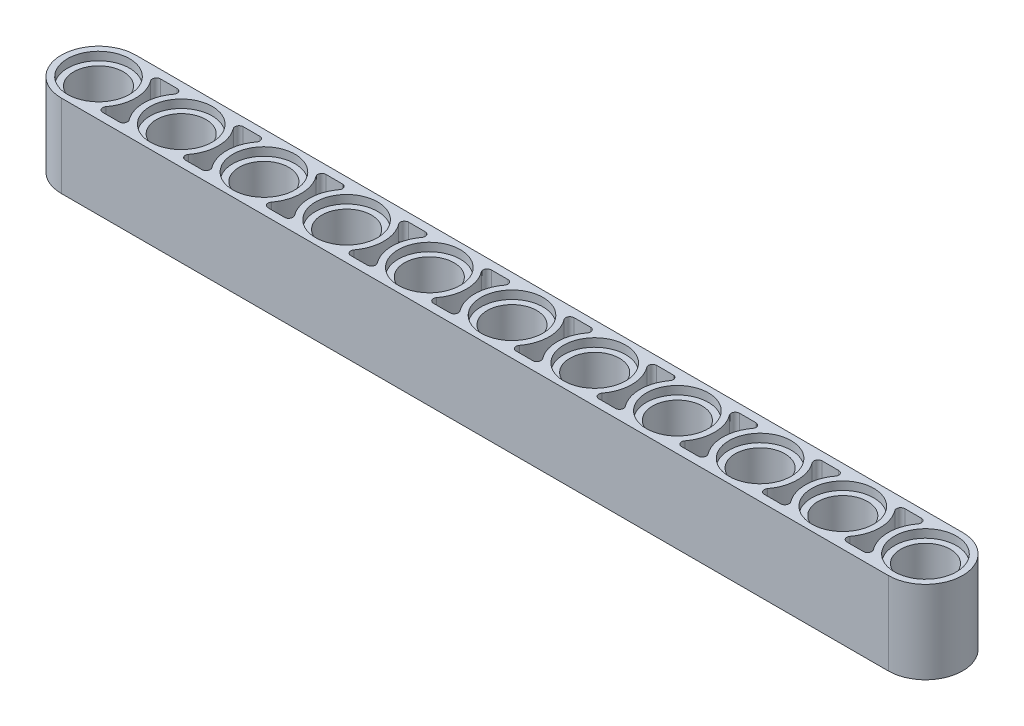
SolidWorks part; units mm, degrees
ref_plane "Front Plane" through (0, 0, 0) normal (0, 0, 1) x (1, 0, 0)
ref_plane "Top Plane" through (0, 0, 0) normal (0, 1, 0) x (1, 0, 0)
ref_plane "Right Plane" through (0, 0, 0) normal (1, 0, 0) x (0, 0, -1)
sketch "Sketch1" plane through (0, 0, 0) normal (0, 1, 0) x (1, 0, 0)
  line L0 (0, 0) -> (8, 0) construction
  line L1 (0, -3.6) -> (112, -3.6)
  line L2 (0, 3.6) -> (112, 3.6)
  circle A0 centre (0, 0) radius 2.4
  circle A1 centre (8, 0) radius 2.4
  circle A2 centre (16, 0) radius 2.4
  circle A3 centre (24, 0) radius 2.4
  circle A4 centre (32, 0) radius 2.4
  circle A5 centre (40, 0) radius 2.4
  circle A6 centre (48, 0) radius 2.4
  circle A7 centre (56, 0) radius 2.4
  circle A8 centre (64, 0) radius 2.4
  circle A9 centre (72, 0) radius 2.4
  circle A10 centre (80, 0) radius 2.4
  circle A11 centre (88, 0) radius 2.4
  circle A12 centre (96, 0) radius 2.4
  circle A13 centre (104, 0) radius 2.4
  circle A14 centre (112, 0) radius 2.4
  arc A15 (112, 3.6) -> (112, -3.6) centre (112, 0) cw
  arc A16 (0, 3.6) -> (0, -3.6) centre (0, 0) ccw
  dimension "D1" = 4.8
  dimension "D2" = 8
  dimension "D3" = 15
  dimension "D4" = 3.6
  dimension "D5" = 3.6
extrude "Boss-Extrude1" add sketch "Sketch1" along normal blind 8
sketch "Sketch2" plane through (0, 8, 0) normal (0, 1, 0) x (1, 0, 0)
  line L0 (0, 0) -> (8, 0) construction
  circle A0 centre (0, 0) radius 3
  circle A1 centre (8, 0) radius 3
  circle A2 centre (16, 0) radius 3
  circle A3 centre (24, 0) radius 3
  circle A4 centre (32, 0) radius 3
  circle A5 centre (40, 0) radius 3
  circle A6 centre (48, 0) radius 3
  circle A7 centre (56, 0) radius 3
  circle A8 centre (64, 0) radius 3
  circle A9 centre (72, 0) radius 3
  circle A10 centre (80, 0) radius 3
  circle A11 centre (88, 0) radius 3
  circle A12 centre (96, 0) radius 3
  circle A13 centre (104, 0) radius 3
  circle A14 centre (112, 0) radius 3
  dimension "D1" = 6
  dimension "D2" = 8
extrude "Cut-Extrude1" cut sketch "Sketch2" against normal blind 0.8
sketch "Sketch3" plane through (0, 8, 0) normal (0, 1, 0) x (1, 0, 0)
  line L0 (3.2, 2.8) -> (4.8, 2.8)
  line L1 (4.8, -2.8) -> (3.2, -2.8)
  line L2 (112, 3.6) -> (0, 3.6) construction
  line L3 (0, -3.6) -> (112, -3.6) construction
  line L4 (11.2, 2.8) -> (12.8, 2.8)
  line L5 (12.8, -2.8) -> (11.2, -2.8)
  line L6 (19.2, 2.8) -> (20.8, 2.8)
  line L7 (20.8, -2.8) -> (19.2, -2.8)
  line L8 (27.2, 2.8) -> (28.8, 2.8)
  line L9 (28.8, -2.8) -> (27.2, -2.8)
  line L10 (35.2, 2.8) -> (36.8, 2.8)
  line L11 (36.8, -2.8) -> (35.2, -2.8)
  line L12 (43.2, 2.8) -> (44.8, 2.8)
  line L13 (44.8, -2.8) -> (43.2, -2.8)
  line L14 (51.2, 2.8) -> (52.8, 2.8)
  line L15 (52.8, -2.8) -> (51.2, -2.8)
  line L16 (59.2, 2.8) -> (60.8, 2.8)
  line L17 (60.8, -2.8) -> (59.2, -2.8)
  line L18 (67.2, 2.8) -> (68.8, 2.8)
  line L19 (68.8, -2.8) -> (67.2, -2.8)
  line L20 (75.2, 2.8) -> (76.8, 2.8)
  line L21 (76.8, -2.8) -> (75.2, -2.8)
  line L22 (83.2, 2.8) -> (84.8, 2.8)
  line L23 (84.8, -2.8) -> (83.2, -2.8)
  line L24 (91.2, 2.8) -> (92.8, 2.8)
  line L25 (92.8, -2.8) -> (91.2, -2.8)
  line L26 (99.2, 2.8) -> (100.8, 2.8)
  line L27 (100.8, -2.8) -> (99.2, -2.8)
  line L28 (107.2, 2.8) -> (108.8, 2.8)
  line L29 (108.8, -2.8) -> (107.2, -2.8)
  line L30 (3.2, 2.8) -> (11.2, 2.8) construction
  arc A0 (2.88, -2.16) -> (2.88, 2.16) centre (0, 0) ccw
  arc A1 (5.12, 2.16) -> (5.12, -2.16) centre (8, 0) ccw
  arc A2 (3.2, -2.8) -> (2.88, -2.16) centre (3.2, -2.4) cw
  arc A3 (5.12, -2.16) -> (4.8, -2.8) centre (4.8, -2.4) cw
  arc A4 (5.12, 2.16) -> (4.8, 2.8) centre (4.8, 2.4) ccw
  arc A5 (3.2, 2.8) -> (2.88, 2.16) centre (3.2, 2.4) ccw
  arc A6 (10.88, -2.16) -> (10.88, 2.16) centre (8, 0) ccw
  arc A7 (13.12, 2.16) -> (13.12, -2.16) centre (16, 0) ccw
  arc A8 (11.2, -2.8) -> (10.88, -2.16) centre (11.2, -2.4) cw
  arc A9 (13.12, -2.16) -> (12.8, -2.8) centre (12.8, -2.4) cw
  arc A10 (13.12, 2.16) -> (12.8, 2.8) centre (12.8, 2.4) ccw
  arc A11 (11.2, 2.8) -> (10.88, 2.16) centre (11.2, 2.4) ccw
  arc A12 (18.88, -2.16) -> (18.88, 2.16) centre (16, 0) ccw
  arc A13 (21.12, 2.16) -> (21.12, -2.16) centre (24, 0) ccw
  arc A14 (19.2, -2.8) -> (18.88, -2.16) centre (19.2, -2.4) cw
  arc A15 (21.12, -2.16) -> (20.8, -2.8) centre (20.8, -2.4) cw
  arc A16 (21.12, 2.16) -> (20.8, 2.8) centre (20.8, 2.4) ccw
  arc A17 (19.2, 2.8) -> (18.88, 2.16) centre (19.2, 2.4) ccw
  arc A18 (26.88, -2.16) -> (26.88, 2.16) centre (24, 0) ccw
  arc A19 (29.12, 2.16) -> (29.12, -2.16) centre (32, 0) ccw
  arc A20 (27.2, -2.8) -> (26.88, -2.16) centre (27.2, -2.4) cw
  arc A21 (29.12, -2.16) -> (28.8, -2.8) centre (28.8, -2.4) cw
  arc A22 (29.12, 2.16) -> (28.8, 2.8) centre (28.8, 2.4) ccw
  arc A23 (27.2, 2.8) -> (26.88, 2.16) centre (27.2, 2.4) ccw
  arc A24 (34.88, -2.16) -> (34.88, 2.16) centre (32, 0) ccw
  arc A25 (37.12, 2.16) -> (37.12, -2.16) centre (40, 0) ccw
  arc A26 (35.2, -2.8) -> (34.88, -2.16) centre (35.2, -2.4) cw
  arc A27 (37.12, -2.16) -> (36.8, -2.8) centre (36.8, -2.4) cw
  arc A28 (37.12, 2.16) -> (36.8, 2.8) centre (36.8, 2.4) ccw
  arc A29 (35.2, 2.8) -> (34.88, 2.16) centre (35.2, 2.4) ccw
  arc A30 (42.88, -2.16) -> (42.88, 2.16) centre (40, 0) ccw
  arc A31 (45.12, 2.16) -> (45.12, -2.16) centre (48, 0) ccw
  arc A32 (43.2, -2.8) -> (42.88, -2.16) centre (43.2, -2.4) cw
  arc A33 (45.12, -2.16) -> (44.8, -2.8) centre (44.8, -2.4) cw
  arc A34 (45.12, 2.16) -> (44.8, 2.8) centre (44.8, 2.4) ccw
  arc A35 (43.2, 2.8) -> (42.88, 2.16) centre (43.2, 2.4) ccw
  arc A36 (50.88, -2.16) -> (50.88, 2.16) centre (48, 0) ccw
  arc A37 (53.12, 2.16) -> (53.12, -2.16) centre (56, 0) ccw
  arc A38 (51.2, -2.8) -> (50.88, -2.16) centre (51.2, -2.4) cw
  arc A39 (53.12, -2.16) -> (52.8, -2.8) centre (52.8, -2.4) cw
  arc A40 (53.12, 2.16) -> (52.8, 2.8) centre (52.8, 2.4) ccw
  arc A41 (51.2, 2.8) -> (50.88, 2.16) centre (51.2, 2.4) ccw
  arc A42 (58.88, -2.16) -> (58.88, 2.16) centre (56, 0) ccw
  arc A43 (61.12, 2.16) -> (61.12, -2.16) centre (64, 0) ccw
  arc A44 (59.2, -2.8) -> (58.88, -2.16) centre (59.2, -2.4) cw
  arc A45 (61.12, -2.16) -> (60.8, -2.8) centre (60.8, -2.4) cw
  arc A46 (61.12, 2.16) -> (60.8, 2.8) centre (60.8, 2.4) ccw
  arc A47 (59.2, 2.8) -> (58.88, 2.16) centre (59.2, 2.4) ccw
  arc A48 (66.88, -2.16) -> (66.88, 2.16) centre (64, 0) ccw
  arc A49 (69.12, 2.16) -> (69.12, -2.16) centre (72, 0) ccw
  arc A50 (67.2, -2.8) -> (66.88, -2.16) centre (67.2, -2.4) cw
  arc A51 (69.12, -2.16) -> (68.8, -2.8) centre (68.8, -2.4) cw
  arc A52 (69.12, 2.16) -> (68.8, 2.8) centre (68.8, 2.4) ccw
  arc A53 (67.2, 2.8) -> (66.88, 2.16) centre (67.2, 2.4) ccw
  arc A54 (74.88, -2.16) -> (74.88, 2.16) centre (72, 0) ccw
  arc A55 (77.12, 2.16) -> (77.12, -2.16) centre (80, 0) ccw
  arc A56 (75.2, -2.8) -> (74.88, -2.16) centre (75.2, -2.4) cw
  arc A57 (77.12, -2.16) -> (76.8, -2.8) centre (76.8, -2.4) cw
  arc A58 (77.12, 2.16) -> (76.8, 2.8) centre (76.8, 2.4) ccw
  arc A59 (75.2, 2.8) -> (74.88, 2.16) centre (75.2, 2.4) ccw
  arc A60 (82.88, -2.16) -> (82.88, 2.16) centre (80, 0) ccw
  arc A61 (85.12, 2.16) -> (85.12, -2.16) centre (88, 0) ccw
  arc A62 (83.2, -2.8) -> (82.88, -2.16) centre (83.2, -2.4) cw
  arc A63 (85.12, -2.16) -> (84.8, -2.8) centre (84.8, -2.4) cw
  arc A64 (85.12, 2.16) -> (84.8, 2.8) centre (84.8, 2.4) ccw
  arc A65 (83.2, 2.8) -> (82.88, 2.16) centre (83.2, 2.4) ccw
  arc A66 (90.88, -2.16) -> (90.88, 2.16) centre (88, 0) ccw
  arc A67 (93.12, 2.16) -> (93.12, -2.16) centre (96, 0) ccw
  arc A68 (91.2, -2.8) -> (90.88, -2.16) centre (91.2, -2.4) cw
  arc A69 (93.12, -2.16) -> (92.8, -2.8) centre (92.8, -2.4) cw
  arc A70 (93.12, 2.16) -> (92.8, 2.8) centre (92.8, 2.4) ccw
  arc A71 (91.2, 2.8) -> (90.88, 2.16) centre (91.2, 2.4) ccw
  arc A72 (98.88, -2.16) -> (98.88, 2.16) centre (96, 0) ccw
  arc A73 (101.12, 2.16) -> (101.12, -2.16) centre (104, 0) ccw
  arc A74 (99.2, -2.8) -> (98.88, -2.16) centre (99.2, -2.4) cw
  arc A75 (101.12, -2.16) -> (100.8, -2.8) centre (100.8, -2.4) cw
  arc A76 (101.12, 2.16) -> (100.8, 2.8) centre (100.8, 2.4) ccw
  arc A77 (99.2, 2.8) -> (98.88, 2.16) centre (99.2, 2.4) ccw
  arc A78 (106.88, -2.16) -> (106.88, 2.16) centre (104, 0) ccw
  arc A79 (109.12, 2.16) -> (109.12, -2.16) centre (112, 0) ccw
  arc A80 (107.2, -2.8) -> (106.88, -2.16) centre (107.2, -2.4) cw
  arc A81 (109.12, -2.16) -> (108.8, -2.8) centre (108.8, -2.4) cw
  arc A82 (109.12, 2.16) -> (108.8, 2.8) centre (108.8, 2.4) ccw
  arc A83 (107.2, 2.8) -> (106.88, 2.16) centre (107.2, 2.4) ccw
  dimension "D3" = 0.4
  dimension "D1" = 0.8
  dimension "D2" = 0.8
  dimension "D4" = 8
extrude "Cut-Extrude2" cut sketch "Sketch3" against normal blind 3.2
ref_plane "Plane1" through (0, 4, 0) normal (0, 1, 0) x (1, 0, 0)
mirror "Mirror1" about plane through (0, 4, 0) normal (0, 1, 0) of "Cut-Extrude2", "Cut-Extrude1"
sketch "Sketch4" plane through (0, 8, 0) normal (0, 1, 0) x (1, 0, 0)
  line L0 (96, 3.6) -> (112, 3.6)
  line L1 (112, -3.6) -> (96, -3.6)
  arc A0 (96, -3.6) -> (96, 3.6) centre (96, 0) ccw
  arc A1 (112, -3.6) -> (112, 3.6) centre (112, 0) ccw construction
  arc A2 (112, -3.6) -> (112, 3.6) centre (112, 0) ccw
extrude "Cut-Extrude3" cut sketch "Sketch4" against normal up to surface (8 mm away)
sketch "Sketch5" plane through (0, 8, 0) normal (0, 1, 0) x (1, 0, 0)
  line L1 (80, 3.6) -> (96, 3.6)
  line L2 (80, -3.6) -> (96, -3.6)
  arc A1 (96, -3.6) -> (96, 3.6) centre (96, 0) ccw
  arc A2 (80, 3.6) -> (80, -3.6) centre (80, 0) cw
  point P4 (88, 0)
extrude "Cut-Extrude4" cut sketch "Sketch5" against normal up to surface (8 mm away)
